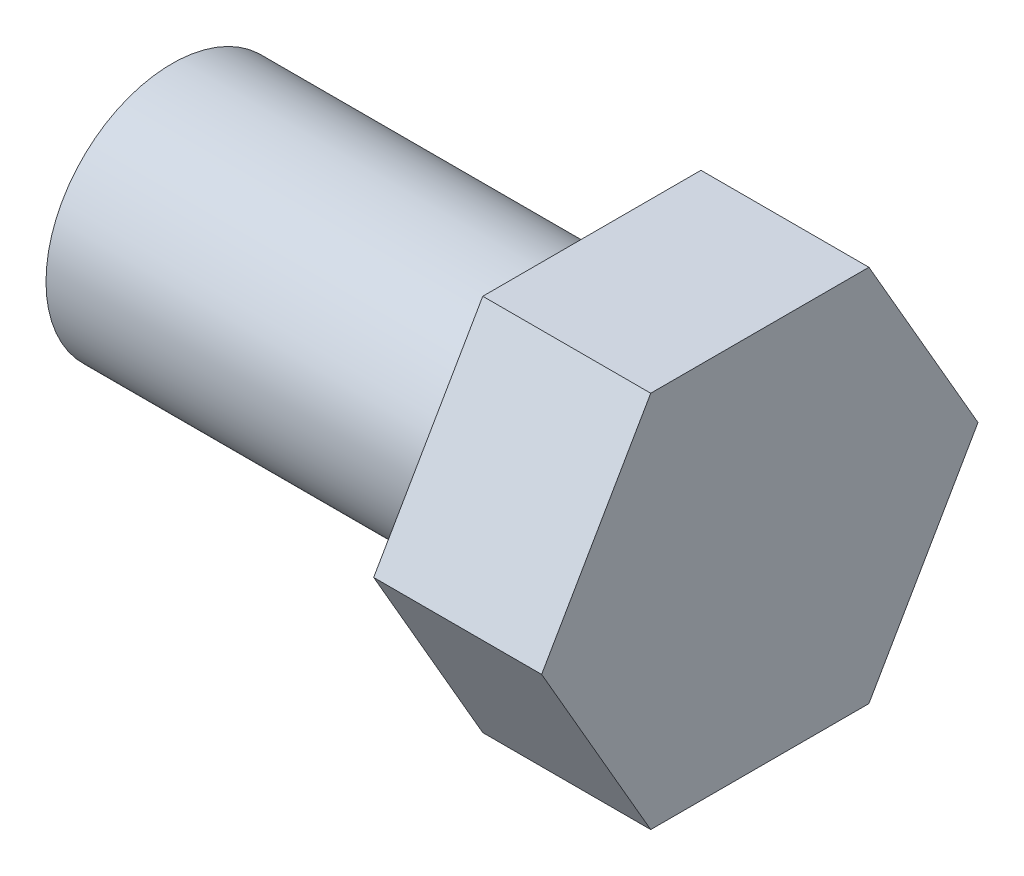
SolidWorks part; units mm, degrees
ref_plane "Front Plane" through (0, 0, 0) normal (0, 0, 1) x (1, 0, 0)
ref_plane "Top Plane" through (0, 0, 0) normal (0, 1, 0) x (1, 0, 0)
ref_plane "Right Plane" through (0, 0, 0) normal (1, 0, 0) x (0, 0, -1)
sketch "Sketch1" plane through (0, 0, 0) normal (1, 0, 0) x (0, 0, -1)
  line L1 (4.1244, 7.1438) -> (-4.1244, 7.1437)
  line L2 (-4.1244, 7.1437) -> (-8.2489, 0)
  line L3 (-8.2489, 0) -> (-4.1244, -7.1438)
  line L4 (-4.1244, -7.1438) -> (4.1244, -7.1438)
  line L5 (4.1244, -7.1438) -> (8.2489, 0)
  line L6 (8.2489, 0) -> (4.1244, 7.1438)
  circle A0 centre (0, 0) radius 7.1438 construction
  dimension "D1" = 14.2875
extrude "Boss-Extrude1" add sketch "Sketch1" along normal blind 6.35
sketch "Sketch2" plane through (0, 0, 0) normal (-1, 0, 0) x (0, 0, 1)
  circle A0 centre (0, 0) radius 4.7625
  dimension "D1" = 9.525
extrude "Boss-Extrude2" add sketch "Sketch2" along normal blind 15.875
